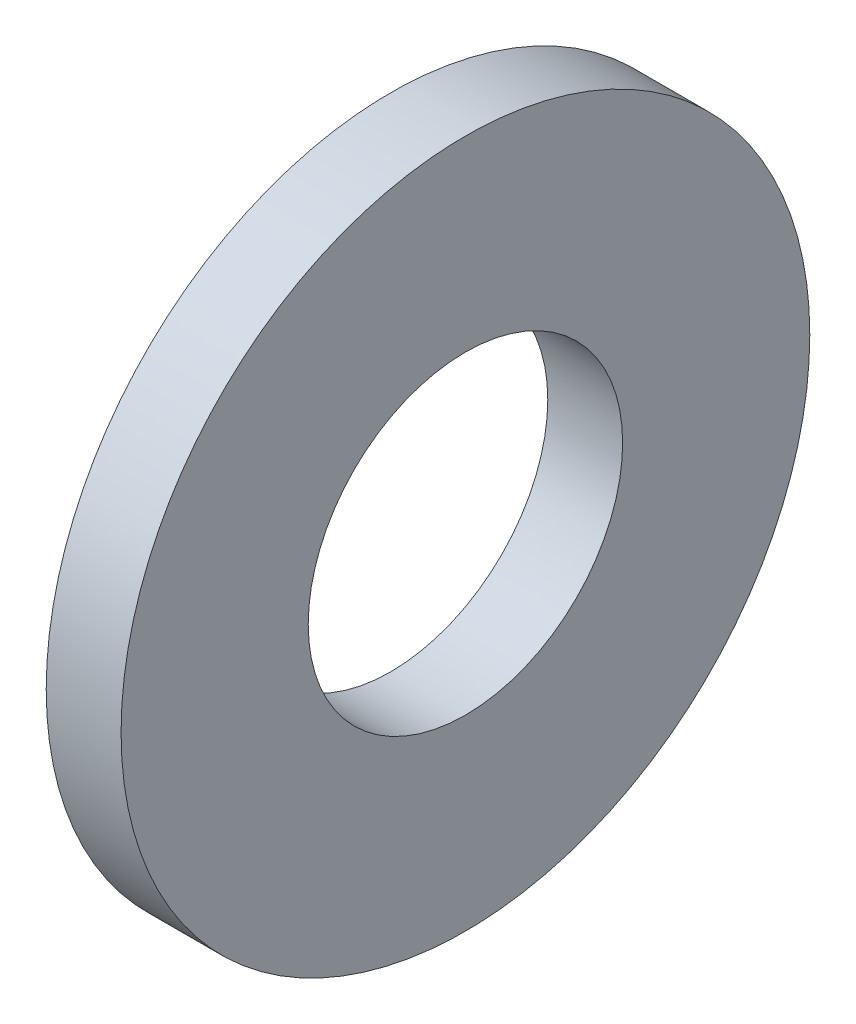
SolidWorks part; units mm, degrees
ref_plane "Plane1" through (0, 0, 0) normal (0, 0, 1) x (1, 0, 0)
ref_plane "Plane2" through (0, 0, 0) normal (0, 1, 0) x (1, 0, 0)
ref_plane "Plane3" through (0, 0, 0) normal (1, 0, 0) x (0, 0, -1)
other "Configuration Table"
sketch "Sketch1" plane through (0, 0, 0) normal (1, 0, 0) x (0, 0, -1)
  circle A0 centre (0, 0) radius 5.25
  circle A1 centre (0, 0) radius 11.5
  dimension "Insid_Dia" = 10.5
  dimension "OutsideDia" = 23
extrude "Base-Extrude" add sketch "Sketch1" along normal blind 2.5
